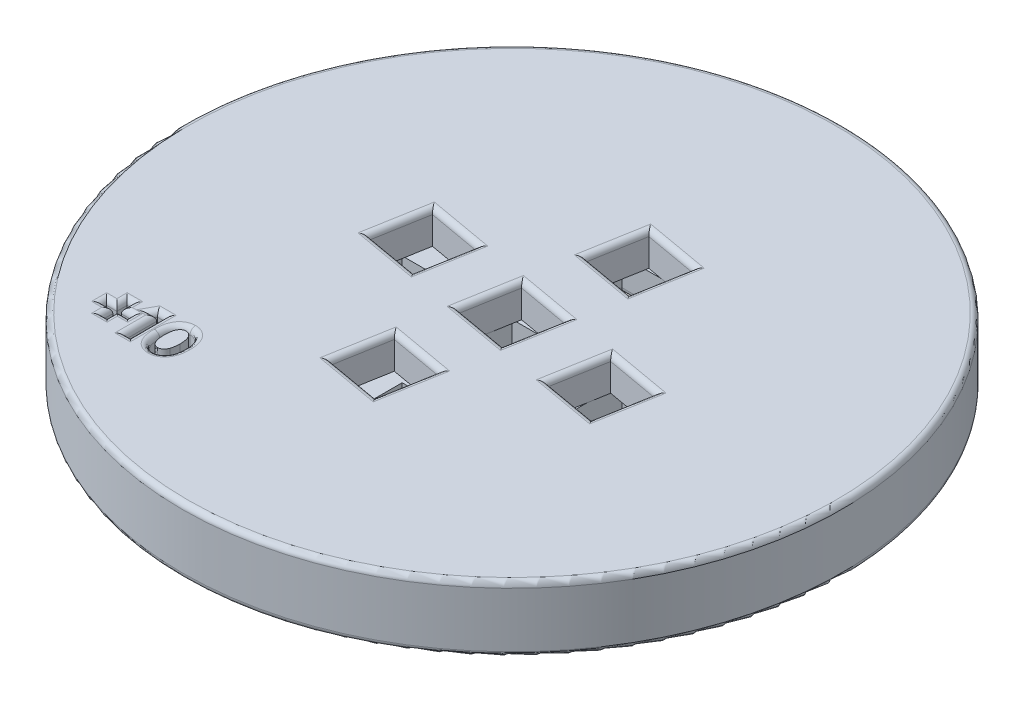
SolidWorks part; units mm, degrees
ref_plane "Front Plane" through (0, 0, 0) normal (0, 0, 1) x (1, 0, 0)
ref_plane "Top Plane" through (0, 0, 0) normal (0, 1, 0) x (1, 0, 0)
ref_plane "Right Plane" through (0, 0, 0) normal (1, 0, 0) x (0, 0, -1)
sketch "Sketch1" plane through (0, 0, 0) normal (0, 1, 0) x (1, 0, 0)
  circle A0 centre (0, 0) radius 30
extrude "Boss-Extrude1" add sketch "Sketch1" along normal blind 6
sketch "Sketch2" plane through (0, 6, 0) normal (0, 1, 0) x (1, 0, 0)
  line L0 (0, 0) -> (0, -10) construction
  line L1 (0, 0) -> (10, 0) construction
  line L2 (0, 0) -> (-10, 0) construction
  line L3 (0, 0) -> (0, 10) construction
  line L5 (-2.5, -7.5) -> (2.5, -7.5)
  line L6 (-2.5, -7.5) -> (-2.5, -12.5)
  line L7 (-2.5, -12.5) -> (2.5, -12.5)
  line L8 (2.5, -7.5) -> (2.5, -12.5)
  line L9 (-2.5, -7.5) -> (2.5, -12.5) construction
  line L10 (-2.5, -12.5) -> (2.5, -7.5) construction
  line L11 (-7.5, -2.5) -> (-12.5, -2.5)
  line L12 (-7.5, -2.5) -> (-7.5, 2.5)
  line L13 (-7.5, 2.5) -> (-12.5, 2.5)
  line L14 (-12.5, -2.5) -> (-12.5, 2.5)
  line L15 (-7.5, -2.5) -> (-12.5, 2.5) construction
  line L16 (-7.5, 2.5) -> (-12.5, -2.5) construction
  line L17 (2.5, -2.5) -> (-2.5, -2.5)
  line L18 (2.5, -2.5) -> (2.5, 2.5)
  line L19 (2.5, 2.5) -> (-2.5, 2.5)
  line L20 (-2.5, -2.5) -> (-2.5, 2.5)
  line L21 (2.5, -2.5) -> (-2.5, 2.5) construction
  line L22 (2.5, 2.5) -> (-2.5, -2.5) construction
  line L23 (-2.5, 12.5) -> (2.5, 12.5)
  line L24 (-2.5, 12.5) -> (-2.5, 7.5)
  line L25 (-2.5, 7.5) -> (2.5, 7.5)
  line L26 (2.5, 12.5) -> (2.5, 7.5)
  line L27 (-2.5, 12.5) -> (2.5, 7.5) construction
  line L28 (-2.5, 7.5) -> (2.5, 12.5) construction
  line L29 (12.5, -2.5) -> (7.5, -2.5)
  line L30 (12.5, -2.5) -> (12.5, 2.5)
  line L31 (12.5, 2.5) -> (7.5, 2.5)
  line L32 (7.5, -2.5) -> (7.5, 2.5)
  line L33 (12.5, -2.5) -> (7.5, 2.5) construction
  line L34 (12.5, 2.5) -> (7.5, -2.5) construction
  dimension "D1" = 5
  dimension "D2" = 10
  dimension "D3" = 5
  dimension "D4" = 5
  dimension "D5" = 5
  dimension "D6" = 5
  dimension "D7" = 5
  dimension "D8" = 5
sketch "Sketch3" plane through (0, 6, 0) normal (0, 1, 0) x (1, 0, 0)
sketch "Sketch4" plane through (0, 0, 0) normal (0, -1, 0) x (-1, 0, 0)
  line L0 (0, 0) -> (-10, 0) construction
  line L1 (0, 0) -> (0, -10) construction
  line L2 (0, 0) -> (0, 10) construction
  line L3 (0, 0) -> (10, 0) construction
  line L5 (-2.5, 2.5) -> (2.5, 2.5)
  line L6 (-2.5, 2.5) -> (-2.5, -2.5)
  line L7 (-2.5, -2.5) -> (2.5, -2.5)
  line L8 (2.5, 2.5) -> (2.5, -2.5)
  line L9 (-2.5, 2.5) -> (2.5, -2.5) construction
  line L10 (-2.5, -2.5) -> (2.5, 2.5) construction
  line L11 (-2.5, -7.5) -> (2.5, -7.5)
  line L12 (-2.5, -7.5) -> (-2.5, -12.5)
  line L13 (-2.5, -12.5) -> (2.5, -12.5)
  line L14 (2.5, -7.5) -> (2.5, -12.5)
  line L15 (-2.5, -7.5) -> (2.5, -12.5) construction
  line L16 (-2.5, -12.5) -> (2.5, -7.5) construction
  line L17 (7.5, 2.5) -> (12.5, 2.5)
  line L18 (7.5, 2.5) -> (7.5, -2.5)
  line L19 (7.5, -2.5) -> (12.5, -2.5)
  line L20 (12.5, 2.5) -> (12.5, -2.5)
  line L21 (7.5, 2.5) -> (12.5, -2.5) construction
  line L22 (7.5, -2.5) -> (12.5, 2.5) construction
  line L23 (-12.5, 2.5) -> (-7.5, 2.5)
  line L24 (-12.5, 2.5) -> (-12.5, -2.5)
  line L25 (-12.5, -2.5) -> (-7.5, -2.5)
  line L26 (-7.5, 2.5) -> (-7.5, -2.5)
  line L27 (-12.5, 2.5) -> (-7.5, -2.5) construction
  line L28 (-12.5, -2.5) -> (-7.5, 2.5) construction
  line L29 (2.5, 7.5) -> (-2.5, 7.5)
  line L30 (2.5, 7.5) -> (2.5, 12.5)
  line L31 (2.5, 12.5) -> (-2.5, 12.5)
  line L32 (-2.5, 7.5) -> (-2.5, 12.5)
  line L33 (2.5, 7.5) -> (-2.5, 12.5) construction
  line L34 (2.5, 12.5) -> (-2.5, 7.5) construction
  dimension "D1" = 5
  dimension "D2" = 5
  dimension "D3" = 5
  dimension "D4" = 5
  dimension "D5" = 5
  dimension "D6" = 5
extrude "Cut-Extrude2" cut sketch "Sketch4" against normal blind 3
fillet "Fillet2" radius 0.5 21 edges at (0, 0, 30) (2.5, 0, 0) (0, 0, 2.5) (-2.5, 0, 0) (0, 0, -2.5) (2.5, 0, 10) (0, 0, 12.5) (-2.5, 0, 10) (0, 0, 7.5) (-7.5, 0, 0) (-10, 0, 2.5) (-12.5, 0, 0) (-10, 0, -2.5) (12.5, 0, 0) (10, 0, 2.5) (7.5, 0, 0) (10, 0, -2.5) (-2.5, 0, -10) (0, 0, -12.5) (2.5, 0, -10) (0, 0, -7.5)
fillet "Fillet3" radius 0.5 1 edges at (0, 6, 30)
sketch "Sketch5" plane through (0, 6, 0) normal (0, 1, 0) x (1, 0, 0)
sketch "Sketch6" plane through (0, 6, 0) normal (0, 1, 0) x (1, 0, 0)
  line L0 (0, -30) -> (0, 30) construction
  line L1 (0, 0) -> (5.2094, 29.5442) construction
  line L2 (-2.8961, -2.0279) -> (2.0279, -2.8961)
  line L3 (-2.8961, -2.0279) -> (-2.0279, 2.8961)
  line L4 (2.0279, -2.8961) -> (2.8961, 2.0279)
  line L5 (-2.0279, 2.8961) -> (2.8961, 2.0279)
  line L6 (-2.8961, -2.0279) -> (2.8961, 2.0279) construction
  line L7 (2.0279, -2.8961) -> (-2.0279, 2.8961) construction
  line L8 (-1.1597, 7.8202) -> (3.7644, 6.9519)
  line L9 (-1.1597, 7.8202) -> (-0.2914, 12.7442)
  line L10 (3.7644, 6.9519) -> (4.6326, 11.876)
  line L11 (-0.2914, 12.7442) -> (4.6326, 11.876)
  line L12 (-1.1597, 7.8202) -> (4.6326, 11.876) construction
  line L13 (3.7644, 6.9519) -> (-0.2914, 12.7442) construction
  line L14 (0, 0) -> (-5.1226, -29.0518) construction
  line L15 (0.2914, -12.7442) -> (-4.6326, -11.876)
  line L16 (0.2914, -12.7442) -> (1.1597, -7.8202)
  line L17 (-4.6326, -11.876) -> (-3.7644, -6.9519)
  line L18 (1.1597, -7.8202) -> (-3.7644, -6.9519)
  line L19 (0.2914, -12.7442) -> (-3.7644, -6.9519) construction
  line L20 (-4.6326, -11.876) -> (1.1597, -7.8202) construction
  line L21 (0, 0) -> (-29.0518, 5.1226) construction
  line L22 (0, 0) -> (29.0518, -5.1226) construction
  line L23 (11.876, -4.6326) -> (6.9519, -3.7644)
  line L24 (11.876, -4.6326) -> (12.7442, 0.2914)
  line L25 (6.9519, -3.7644) -> (7.8202, 1.1597)
  line L26 (12.7442, 0.2914) -> (7.8202, 1.1597)
  line L27 (11.876, -4.6326) -> (7.8202, 1.1597) construction
  line L28 (6.9519, -3.7644) -> (12.7442, 0.2914) construction
  line L29 (-12.7442, -0.2914) -> (-7.8202, -1.1597)
  line L30 (-12.7442, -0.2914) -> (-11.876, 4.6326)
  line L31 (-7.8202, -1.1597) -> (-6.9519, 3.7644)
  line L32 (-11.876, 4.6326) -> (-6.9519, 3.7644)
  line L33 (-12.7442, -0.2914) -> (-6.9519, 3.7644) construction
  line L34 (-7.8202, -1.1597) -> (-11.876, 4.6326) construction
  line L35 (-19.7925, -19.1465) -> (-12.6703, -19.1465) construction
  circle A0 centre (0, 0) radius 30 construction
  circle A1 centre (0, 0) radius 29.5 construction
  text T0 "<b>+10</b>"
  point P8 (1.7365, 9.8481)
  point P21 (-1.7365, -9.8481)
  point P23 (9.8481, -1.7365)
  point P28 (-9.8481, 1.7365)
  dimension "D1" = 10
  dimension "D2" = 5
  dimension "D3" = 5
  dimension "D4" = 10
  dimension "D5" = 5
  dimension "D6" = 5
  dimension "D7" = 10
  dimension "D8" = 5
  dimension "D9" = 5
  dimension "D10" = 90
  dimension "D11" = 90
  dimension "D12" = 10
  dimension "D13" = 5
  dimension "D14" = 5
  dimension "D15" = 180
  dimension "D16" = 5
  dimension "D17" = 5
  dimension "D18" = 180
  dimension "D19" = 10
  dimension "D20" = 10
extrude "Cut-Extrude3" cut sketch "Sketch6" against normal blind 3
fillet "Fillet4" radius 0.5 42 edges at (-16.393, 6, 16.1547) (-16.2511, 6, 16.3378) (-15.5998, 6, 17.559) (-15.9452, 6, 15.9715) (-19.0801, 6, 17.7218) (-18.612, 6, 18.1899) (-18.4085, 6, 18.658) (-18.205, 6, 18.1899) (-17.7369, 6, 17.7218) (-17.2687, 6, 17.5386) (-17.7369, 6, 17.3555) (-18.205, 6, 16.8873) (-18.4085, 6, 16.4192) (-18.612, 6, 16.8873) (-19.0801, 6, 17.3555) (-19.5482, 6, 17.5386) (-0.4341, 6, 2.462) (2.462, 6, 0.4341) (0.4341, 6, -2.462) (-2.462, 6, -0.4341) (1.3024, 6, -7.3861) (4.1985, 6, -9.414) (2.1706, 6, -12.3101) (-0.7255, 6, -10.2822) (-1.3024, 6, 7.3861) (-4.1985, 6, 9.414) (-2.1706, 6, 12.3101) (0.7255, 6, 10.2822) (10.2822, 6, -0.7255) (7.3861, 6, 1.3024) (9.414, 6, 4.1985) (12.3101, 6, 2.1706) (-10.2822, 6, 0.7255) (-7.3861, 6, -1.3024) (-9.414, 6, -4.1985) (-12.3101, 6, -2.1706) (-16.0069, 6, 17.7422) (-15.8034, 6, 19.1465)
